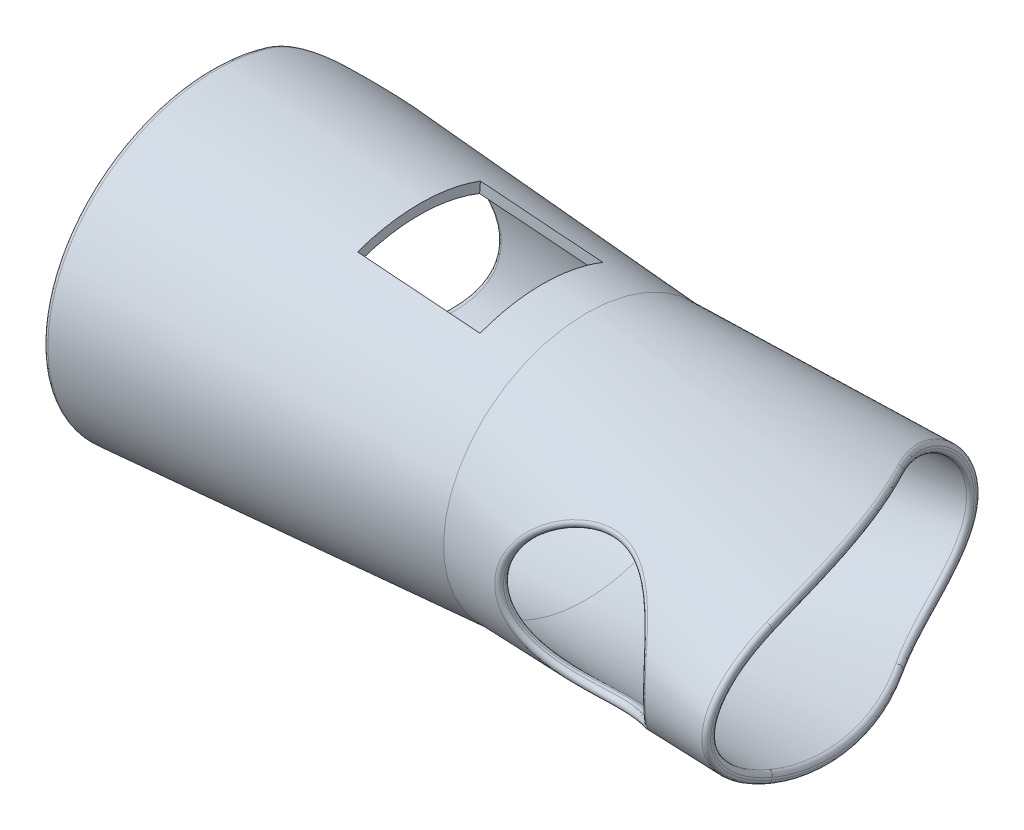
SolidWorks part; units mm, degrees
ref_plane "Front Plane" through (0, 0, 0) normal (0, 0, 1) x (1, 0, 0)
ref_plane "Top Plane" through (0, 0, 0) normal (0, 1, 0) x (1, 0, 0)
ref_plane "Right Plane" through (0, 0, 0) normal (1, 0, 0) x (0, 0, -1)
sketch "Sketch1" plane through (0, 0, 0) normal (1, 0, 0) x (0, 0, -1)
  line L0 (-41.275, 0) -> (41.275, 0) construction
  line L1 (0, 38.1) -> (0, -38.1) construction
  ellipse E0 centre (0, 0) end of major axis (-41.275, 0) minor radius 38.1
  dimension "D2" = 76.2
  dimension "D3" = 82.55
extrude "Boss-Extrude1" add sketch "Sketch1" along normal blind 91.44 draft 4
ref_plane "Plane1" through (165.1, 0, 0) normal (-1, 0, 0) x (0, 0, 1)
sketch "Sketch2" plane through (91.44, 0, 0) normal (1, 0, 0) x (0, 0, -1)
  spline S1 degree 3 poles (34.8809, 0) (34.8809, 4.0805) (34.005, 8.1616) (30.5939, 15.7634) (28.0562, 19.2817) (21.6415, 25.203) (17.7657, 27.6009) (9.2577, 30.8539) (4.6303, 31.7059) (-4.6303, 31.7059) (-9.2577, 30.8539) (-17.7657, 27.6009) (-21.6415, 25.203) (-28.0562, 19.2817) (-30.5939, 15.7634) (-34.005, 8.1616) (-34.8809, 4.0805) (-34.8809, 0) (-34.8809, -4.0805) (-34.005, -8.1616) (-30.5939, -15.7634) (-28.0562, -19.2817) (-21.6415, -25.203) (-17.7657, -27.6009) (-9.2577, -30.8539) (-4.6303, -31.7059) (4.6303, -31.7059) (9.2577, -30.8539) (17.7657, -27.6009) (21.6415, -25.203) (28.0562, -19.2817) (30.5939, -15.7634) (34.005, -8.1616) (34.8809, -4.0805) (34.8809, 0) (34.8809, 4.0805) (34.005, 8.1616) knots 2.748894 3.141593 3.141593 3.141593 3.534292 3.534292 3.926991 3.926991 4.31969 4.31969 4.712389 4.712389 5.105088 5.105088 5.497787 5.497787 5.890486 5.890486 6.283185 6.283185 6.283185 6.675884 6.675884 7.068583 7.068583 7.461283 7.461283 7.853982 7.853982 8.246681 8.246681 8.63938 8.63938 9.032079 9.032079 9.424778 9.424778 9.424778 9.817477 9.817477 10.210176 only from (34.8809, 0) to (34.8809, 0)
  spline S2 degree 3 poles (34.8809, 0) (34.8809, 4.0805) (34.005, 8.1616) (30.5939, 15.7634) (28.0562, 19.2817) (21.6415, 25.203) (17.7657, 27.6009) (9.2577, 30.8539) (4.6303, 31.7059) (-4.6303, 31.7059) (-9.2577, 30.8539) (-17.7657, 27.6009) (-21.6415, 25.203) (-28.0562, 19.2817) (-30.5939, 15.7634) (-34.005, 8.1616) (-34.8809, 4.0805) (-34.8809, 0) (-34.8809, -4.0805) (-34.005, -8.1616) (-30.5939, -15.7634) (-28.0562, -19.2817) (-21.6415, -25.203) (-17.7657, -27.6009) (-9.2577, -30.8539) (-4.6303, -31.7059) (4.6303, -31.7059) (9.2577, -30.8539) (17.7657, -27.6009) (21.6415, -25.203) (28.0562, -19.2817) (30.5939, -15.7634) (34.005, -8.1616) (34.8809, -4.0805) (34.8809, 0) (34.8809, 4.0805) (34.005, 8.1616) knots 2.748894 3.141593 3.141593 3.141593 3.534292 3.534292 3.926991 3.926991 4.31969 4.31969 4.712389 4.712389 5.105088 5.105088 5.497787 5.497787 5.890486 5.890486 6.283185 6.283185 6.283185 6.675884 6.675884 7.068583 7.068583 7.461283 7.461283 7.853982 7.853982 8.246681 8.246681 8.63938 8.63938 9.032079 9.032079 9.424778 9.424778 9.424778 9.817477 9.817477 10.210176 only from (34.8809, 0) to (34.8809, 0)
  dimension "D1" = 0
sketch "Sketch3" plane through (165.1, 0, 0) normal (-1, 0, 0) x (0, 0, 1)
  line L0 (44.45, 0) -> (-44.45, 0) construction
  line L1 (0, 22.225) -> (0, -22.225) construction
  ellipse E0 centre (0, 0) end of major axis (-44.45, 0) minor radius 22.225
  dimension "D1" = 44.45
  dimension "D2" = 88.9
loft "Loft1" add profiles "Sketch2", "Sketch3"
shell "Shell1" thickness 2.54
sketch "Sketch4" plane through (0, 0, 0) normal (0, 1, 0) x (1, 0, 0)
  line L5 (0, 13.1026) -> (0, 41.275)
  line L6 (0, 41.275) -> (34.8848, 38.8356)
  line L9 (145.9358, 42.0444) -> (165.1, 44.45)
  line L10 (165.1, 44.45) -> (165.1, -28.3018)
  line L11 (91.44, 34.8809) -> (0, 41.275) construction
  line L12 (0, 41.275) -> (0, -41.275) construction
  line L13 (91.44, 34.8809) -> (0, 41.275) construction
  line L14 (165.1, -44.45) -> (165.1, 44.45) construction
  arc A0 (0, 13.1026) -> (7.8751, 25.0064) centre (12.9342, 13.1026) cw
  arc A1 (7.8751, 25.0064) -> (34.8848, 38.8356) centre (-75.3883, 220.9184) ccw
  arc A2 (145.9358, 42.0444) -> (152.8756, 15.8883) centre (194.8149, 41.0146) ccw
  arc A3 (152.8756, 15.8883) -> (165.1, -28.3018) centre (79.1161, -28.3018) cw
extrude "Cut-Extrude1" cut sketch "Sketch4" against normal through all and the other way through all
sketch "Sketch6" plane through (0, 0, 0) normal (0, 0, 1) x (1, 0, 0)
  line L0 (0, 0) -> (127, 0) construction
  line L1 (106.934, 0) -> (147.066, 0) construction
  line L2 (127, 16.8021) -> (127, -16.8021) construction
  line L4 (165.1, -17.1392) -> (165.1, 17.1392) construction
  ellipse E0 centre (127, 0) end of major axis (147.066, 0) minor radius 16.8021
  dimension "D1" = 40.132
  dimension "D2" = 33.6042
  dimension "D3" = 38.1
extrude "Cut-Extrude2" cut sketch "Sketch6" along normal through all
fillet "Fillet1" radius 1.016 18 edges at (161.815, 22.5165, 4.762) (162.2856, -22.3443, 6.4828) (145.9325, 1.6239, -41.8752) (161.7217, 19.9817, 4.4366) (162.8153, -19.5173, 8.6124) (145.9529, 1.0414, -39.3599) (2.929, -29.4496, -21.2996) (1.3104, 30.99, -18.7755) (30.9794, 1.465, -36.5269) (2.9267, -32.3998, -21.2968) (1.3509, 33.7853, -18.8576) (34.862, 1.0003, -38.8218) (165.1, -0.9308, -41.8389) (107.3771, 3.5114, 36.7) (107.3013, 3.1999, 34.1486) (0, -6.8038, -38.0101) (0, 3.5338, 41.0957)
sketch "Sketch8" plane through (0, 0, 0) normal (0, 0, 1) x (1, 0, 0)
  line L0 (46.2634, 34.8649) -> (1.0869, 38.024) construction
  line L1 (91.44, 31.7059) -> (1.0869, 38.024) construction
  line L2 (1.0869, -38.024) -> (46.2634, -34.8649) construction
  line L3 (1.0869, -38.024) -> (91.44, -31.7059) construction
sketch3d "3DSketch1"
  line L0 (1.0869, 38.024, 0) -> (1.0869, 38.024, -26.0467) construction
  line L1 (1.0869, -38.024, 0) -> (1.0869, -38.024, -26.0467) construction
ref_plane "Plane2" through (2.6512, 37.9146, 0) normal (-0.0698, -0.9976, 0) x (-0.9976, 0.0698, 0)
ref_plane "Plane3" through (2.6512, -37.9146, 0) normal (-0.0698, 0.9976, 0) x (0.9976, 0.0698, 0)
sketch "Sketch9" plane through (2.6512, 37.9146, 0) normal (-0.0698, -0.9976, 0) x (-0.9976, 0.0698, 0)
  line L0 (-43.7187, 0) -> (1.5682, 0) construction
  line L1 (-48.2183, -15) -> (-78.2183, -15)
  line L2 (-48.2183, -15) -> (-48.2183, 15)
  line L3 (-48.2183, 15) -> (-78.2183, 15)
  line L4 (-78.2183, -15) -> (-78.2183, 15)
  line L5 (-48.2183, -15) -> (-78.2183, 15) construction
  line L6 (-48.2183, 15) -> (-78.2183, -15) construction
  line L8 (1.5682, 0) -> (2.5817, 0) construction
  spline S0 degree 3 number of poles 82 (-2.4406, 13.1026) -> (2.4406, 13.1026) construction
  point P0 (-63.2183, 0)
  dimension "D1" = 50.8
  dimension "D2" = 30
extrude "Cut-Extrude4" cut sketch "Sketch9" along normal blind 25.4
sketch "Sketch10" plane through (2.6512, -37.9146, 0) normal (-0.0698, 0.9976, 0) x (0.9976, 0.0698, 0)
  line L0 (78.2183, -15) -> (48.2183, -15)
  line L1 (78.2183, -15) -> (78.2183, 15)
  line L2 (78.2183, 15) -> (48.2183, 15)
  line L3 (48.2183, -15) -> (48.2183, 15)
  line L4 (78.2183, -15) -> (48.2183, 15) construction
  line L5 (78.2183, 15) -> (48.2183, -15) construction
  line L6 (48.5828, 0) -> (3.7366, 0) construction
  line L7 (-1.5682, 0) -> (-2.5817, 0) construction
  spline S0 degree 3 number of poles 82 (-2.4406, 13.1026) -> (2.4406, 13.1026) construction
  point P0 (63.2183, 0)
  dimension "D1" = 50.8
  dimension "D2" = 30
extrude "Cut-Extrude5" [suppressed] cut sketch "Sketch10" along normal blind 25.4
